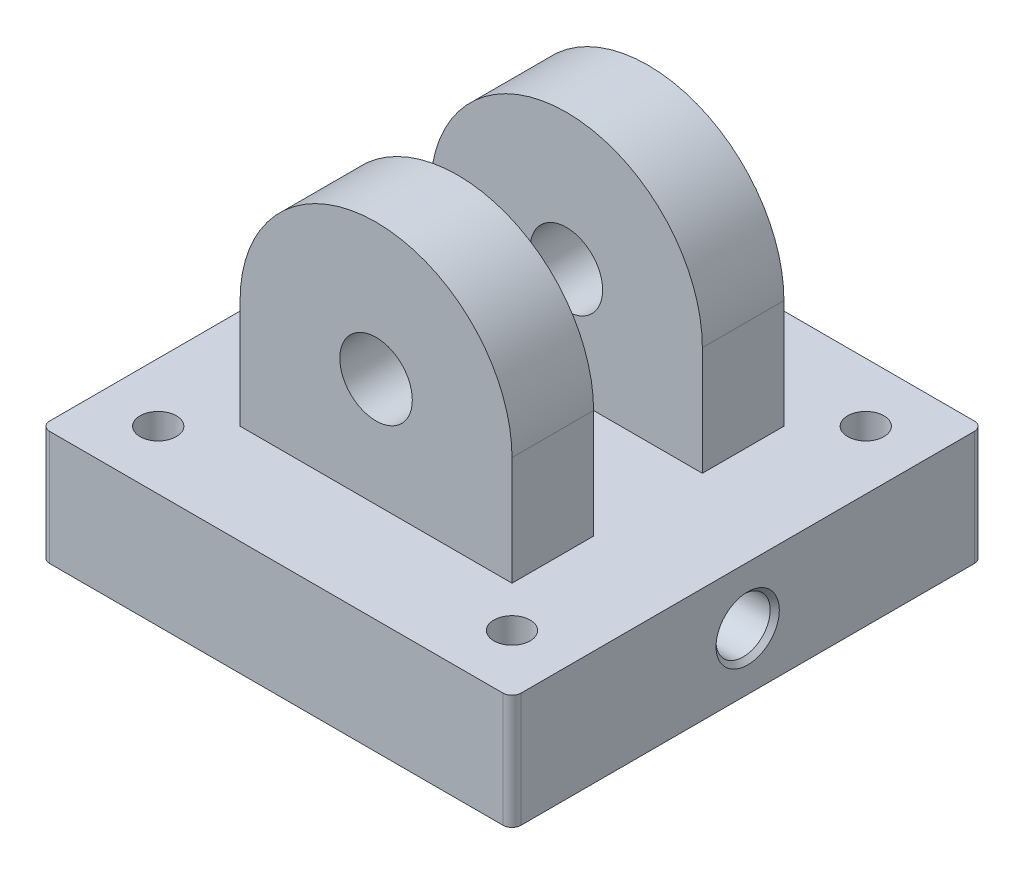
SolidWorks part; units mm, degrees
ref_plane "Front Plane" through (0, 0, 0) normal (0, 0, 1) x (1, 0, 0)
ref_plane "Top Plane" through (0, 0, 0) normal (0, 1, 0) x (1, 0, 0)
ref_plane "Right Plane" through (0, 0, 0) normal (1, 0, 0) x (0, 0, -1)
sketch "Sketch4" plane through (0, 0, 0) normal (0, 1, 0) x (1, 0, 0)
  line L1 (-82.55, 82.55) -> (82.55, 82.55)
  line L2 (-82.55, 82.55) -> (-82.55, -82.55)
  line L3 (-82.55, -82.55) -> (82.55, -82.55)
  line L4 (82.55, 82.55) -> (82.55, -82.55)
  line L5 (-82.55, 82.55) -> (82.55, -82.55) construction
  line L6 (-82.55, -82.55) -> (82.55, 82.55) construction
  point P0 (0, 0)
  dimension "D1" = 165.1
extrude "Boss-Extrude2" add sketch "Sketch4" along normal blind 38.1 and the other way blind 2
sketch "Sketch5" plane through (0, 38.1, 0) normal (0, 1, 0) x (1, 0, 0)
  line L1 (-47.625, 47.625) -> (47.625, 47.625)
  line L2 (-47.625, 47.625) -> (-47.625, -47.625)
  line L3 (-47.625, -47.625) -> (47.625, -47.625)
  line L4 (47.625, 47.625) -> (47.625, -47.625)
  line L5 (-47.625, 47.625) -> (47.625, -47.625) construction
  line L6 (-47.625, -47.625) -> (47.625, 47.625) construction
  point P0 (0, 0)
  dimension "D1" = 95.25
extrude "Boss-Extrude3" add sketch "Sketch5" along normal blind 38.1
sketch "Sketch6" plane through (0, 0, 47.625) normal (0, 0, 1) x (1, 0, 0)
  line L0 (-47.625, 76.2) -> (47.625, 76.2)
  arc A0 (47.625, 76.2) -> (-47.625, 76.2) centre (0, 76.2) ccw
  dimension "D1" = 47.625
extrude "Boss-Extrude4" add sketch "Sketch6" against normal up to vertex
sketch "Sketch7" plane through (0, 0, 47.625) normal (0, 0, 1) x (1, 0, 0)
  circle A0 centre (0, 76.2) radius 12.7
  dimension "D1" = 25.4
extrude "Cut-Extrude1" cut sketch "Sketch7" against normal through all
sketch "Sketch8" plane through (47.625, 0, 0) normal (1, 0, 0) x (0, 0, -1)
  line L0 (-47.625, 38.1) -> (47.625, 38.1) construction
  line L1 (-19.05, 38.1) -> (19.05, 38.1)
  line L2 (-19.05, 38.1) -> (-19.05, 123.825)
  line L3 (-19.05, 123.825) -> (19.05, 123.825)
  line L4 (19.05, 38.1) -> (19.05, 123.825)
  line L5 (47.625, 123.825) -> (-47.625, 123.825) construction
  line L6 (-47.625, 123.825) -> (-47.625, 76.2) construction
  dimension "D1" = 38.1
  dimension "D2" = 28.575
extrude "Cut-Extrude2" cut sketch "Sketch8" against normal through all
fillet "Fillet1" radius 3.175 4 edges at (82.55, 18.05, 82.55) (-82.55, 18.05, 82.55) (-82.55, 18.05, -82.55) (82.55, 18.05, -82.55)
sketch "Sketch9" plane through (0, -2, 0) normal (0, -1, 0) x (1, 0, 0)
  circle A0 centre (0, 0) radius 26
  dimension "D1" = 52
extrude "Cut-Extrude3" cut sketch "Sketch9" against normal blind 36.83
sketch "Sketch10" plane through (0, -2, 0) normal (0, -1, 0) x (1, 0, 0)
  circle A0 centre (0, 0) radius 69.85
  circle A1 centre (0, 0) radius 76.2
  dimension "D1" = 152.4
  dimension "D2" = 139.7
extrude "Cut-Extrude4" cut sketch "Sketch10" against normal blind 8
sketch "Sketch11" plane through (82.55, 0, 0) normal (1, 0, 0) x (0, 0, -1)
  line L0 (-79.375, 18.05) -> (79.375, 18.05) construction
  line L1 (-79.375, 38.1) -> (-79.375, -2) construction
  line L2 (79.375, -2) -> (79.375, 38.1) construction
hole_wizard "1/2-14 NPSM Tapped Hole1" positions "Sketch12" profile "Sketch13" tap size "1/2-14 NPSM" standard "ANSI Inch"
sketch "Sketch12" plane through (82.55, 0, 0) normal (1, 0, 0) x (0, 0, -1)
  line L0 (-79.375, 18.05) -> (79.375, 18.05) construction
  point P0 (0, 18.05)
sketch "Sketch13" plane through (82.55, 18.05, 0) normal (0, 1, 0) x (0, 0, -1)
  line L0 (0, 0) -> (0, 69.2003)
  line L1 (0, 69.2003) -> (9.4869, 63.5)
  line L2 (9.4869, 63.5) -> (9.4869, 1.6002)
  line L3 (9.4869, 1.6002) -> (11.0871, 0)
  line L5 (11.0871, 0) -> (0, 0)
  line L6 (-9.4869, 1.6002) -> (-11.0871, 0) construction
  line L10 (0, 69.2003) -> (-9.4869, 63.5) construction
  line L11 (0, -6.35) -> (0, 107.95) construction
  dimension "Tap Drill Dia." = 18.9738
  dimension "Tap Drill Depth" = 63.5
  dimension "Near C'Sink Dia." = 22.1742
  dimension "Near C'Sink Angle" = 90
  dimension "Drill Angle" = 118
sketch "Sketch16" plane through (0, -2, 0) normal (0, -1, 0) x (1, 0, 0)
  line L0 (82.55, 79.375) -> (82.55, -79.375) construction
  circle A0 centre (50.55, 0) radius 6.35
  dimension "D1" = 12.7
  dimension "D2" = 32
extrude "Cut-Extrude5" cut sketch "Sketch16" against normal blind 25
sketch "Sketch17" plane through (0, -2, 0) normal (0, -1, 0) x (1, 0, 0)
  line L1 (-61.9638, 61.9638) -> (61.9638, 61.9638) construction
  line L2 (-61.9638, 61.9638) -> (-61.9638, -61.9638) construction
  line L3 (-61.9638, -61.9638) -> (61.9638, -61.9638) construction
  line L4 (61.9638, 61.9638) -> (61.9638, -61.9638) construction
  line L5 (-61.9638, 61.9638) -> (61.9638, -61.9638) construction
  line L6 (-61.9638, -61.9638) -> (61.9638, 61.9638) construction
  circle A0 centre (0, 0) radius 87.63 construction
  circle A1 centre (-61.9638, 61.9638) radius 6.35
  circle A2 centre (61.9638, 61.9638) radius 6.35
  circle A3 centre (61.9638, -61.9638) radius 6.35
  circle A4 centre (-61.9638, -61.9638) radius 6.35
  dimension "D1" = 175.26
  dimension "D2" = 12.7
extrude "Cut-Extrude6" cut sketch "Sketch17" against normal through all
